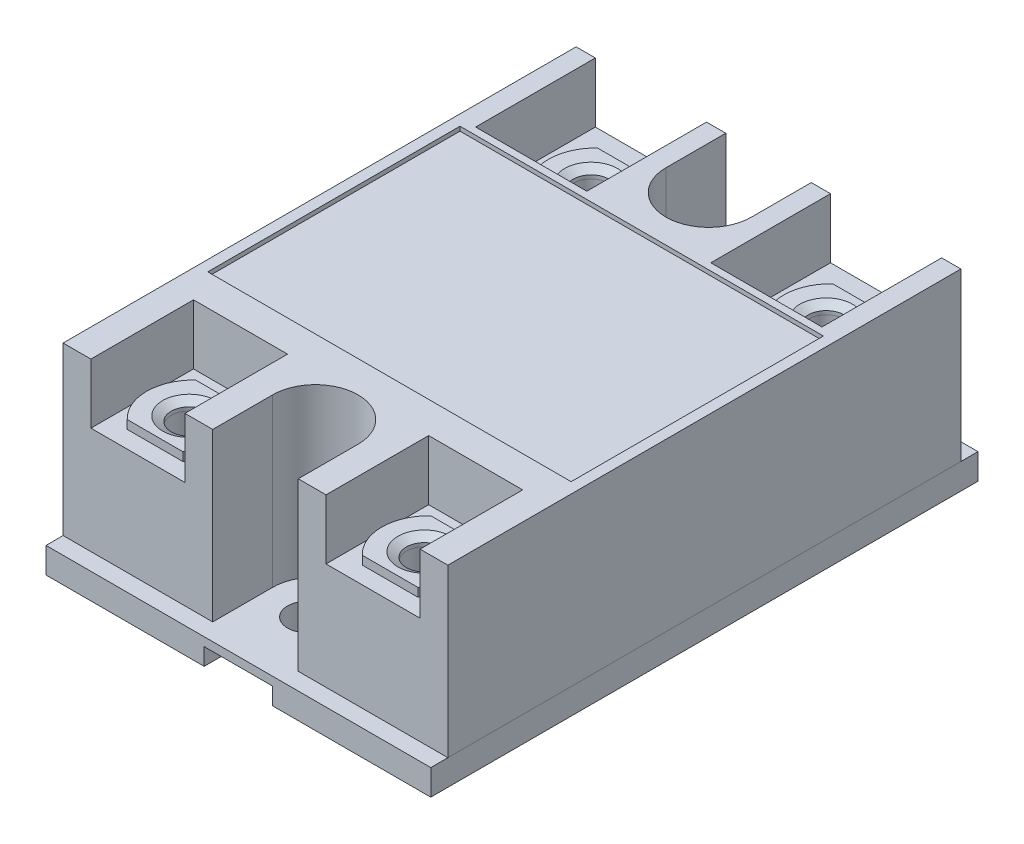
SolidWorks part; units mm, degrees
ref_plane "Front" through (0, 0, 0) normal (0, 0, 1) x (1, 0, 0)
ref_plane "Top" through (0, 0, 0) normal (0, 1, 0) x (1, 0, 0)
ref_plane "Right" through (0, 0, 0) normal (1, 0, 0) x (0, 0, -1)
sketch "Sketch1" plane through (0, 0, 0) normal (0, 1, 0) x (1, 0, 0)
  line L0 (0, 0) -> (0, 60)
  line L1 (0, 0) -> (17.5, 0)
  line L2 (17.5, 0) -> (17.5, 7)
  line L3 (27.5, 0) -> (27.5, 7)
  line L4 (27.5, 0) -> (45, 0)
  line L5 (45, 0) -> (45, 60)
  line L6 (0, 60) -> (17.5, 60)
  line L7 (17.5, 0) -> (27.5, 0) construction
  line L8 (17.5, 60) -> (17.5, 53)
  line L9 (45, 60) -> (27.5, 60)
  line L10 (27.5, 60) -> (27.5, 53)
  arc A0 (27.5, 7) -> (17.5, 7) centre (22.5, 7) ccw
  arc A1 (17.5, 53) -> (27.5, 53) centre (22.5, 53) ccw
  dimension "D1" = 60
  dimension "D2" = 17.5
  dimension "D3" = 7
  dimension "D4" = 10
extrude "Boss-Extrude1" add sketch "Sketch1" along normal blind 19.5
sketch "Sketch2" plane through (0, 19.5, 0) normal (0, 1, 0) x (1, 0, 0)
  line L0 (0, 0) -> (17.5, 0) construction
  line L1 (3.25, 0) -> (14.25, 0)
  line L2 (3.25, 0) -> (3.25, 12)
  line L3 (3.25, 12) -> (14.25, 12)
  line L4 (14.25, 0) -> (14.25, 12)
  line L5 (0, 60) -> (0, 0) construction
  line L7 (22.5, 48) -> (22.5, 12) construction
  line L8 (17.5, 60) -> (0, 60) construction
  line L10 (30.75, 0) -> (30.75, 12)
  line L11 (41.75, 12) -> (30.75, 12)
  line L12 (41.75, 0) -> (41.75, 12)
  line L13 (41.75, 0) -> (30.75, 0)
  line L14 (2.25, 60) -> (15.25, 60)
  line L15 (2.25, 60) -> (2.25, 46)
  line L16 (2.25, 46) -> (15.25, 46)
  line L17 (15.25, 60) -> (15.25, 46)
  line L19 (42.75, 46) -> (29.75, 46)
  line L20 (29.75, 60) -> (29.75, 46)
  line L21 (42.75, 60) -> (29.75, 60)
  line L23 (42.75, 60) -> (42.75, 46)
  arc A0 (17.5, 53) -> (27.5, 53) centre (22.5, 53) ccw construction
  arc A1 (27.5, 7) -> (17.5, 7) centre (22.5, 7) ccw construction
  dimension "D1" = 11
  dimension "D2" = 3.25
  dimension "D3" = 12
  dimension "D4" = 13
  dimension "D5" = 14
  dimension "D6" = 2.25
extrude "Cut-Extrude1" cut sketch "Sketch2" against normal blind 7
sketch "Sketch6" plane through (0, 0, 0) normal (0, 1, 0) x (1, 0, 0)
  line L1 (0, -2) -> (45, -2)
  line L2 (0, -2) -> (0, 62)
  line L3 (0, 62) -> (45, 62)
  line L4 (45, -2) -> (45, 62)
  line L6 (0, 0) -> (17.5, 0) construction
  line L7 (0, 60) -> (0, 0) construction
  line L8 (22.5, 55.5) -> (22.5, 54) construction
  line L9 (24.75, 55.5) -> (24.75, 54)
  line L10 (20.25, 55.5) -> (20.25, 54)
  circle A0 centre (22.5, 6) radius 2.25
  arc A1 (24.75, 55.5) -> (20.25, 55.5) centre (22.5, 55.5) ccw
  arc A2 (20.25, 54) -> (24.75, 54) centre (22.5, 54) ccw
  point P12 (22.5, 54.75)
  dimension "D5" = 4.5
  dimension "D8" = 8
  dimension "D1" = 45
  dimension "D2" = 64
  dimension "D3" = 2
  dimension "D4" = 0
  dimension "D6" = 22.5
  dimension "D7" = 8
  dimension "D9" = 22.5
  dimension "D10" = 4.5
extrude "Boss-Extrude2" add sketch "Sketch6" against normal blind 3 separate body
sketch "Sketch7" plane through (0, 19.5, 0) normal (0, 1, 0) x (1, 0, 0)
  line L0 (22.5, 62) -> (22.5, -11.7233) construction
  line L1 (1.25, 45.1676) -> (43.75, 45.1676)
  line L2 (1.25, 45.1676) -> (1.25, 15.6676)
  line L3 (1.25, 15.6676) -> (43.75, 15.6676)
  line L4 (43.75, 45.1676) -> (43.75, 15.6676)
  line L5 (45, 62) -> (0, 62) construction
  point P8 (22.5, 45.1676)
  dimension "D1" = 42.5
  dimension "D2" = 29.5
extrude "Cut-Extrude2" cut sketch "Sketch7" against normal blind 0.5
hole_wizard "M5x0.8 Tapped Hole1" positions "Sketch13" profile "Sketch12" tap size "M5x0.8" standard "ANSI Metric"
sketch "Sketch13" plane through (0, 12.5, 0) normal (0, 1, 0) x (1, 0, 0)
  line L0 (30.75, 0) -> (41.75, 0) construction
  line L2 (30.75, 12) -> (30.75, 0) construction
  point P0 (36.25, 6)
  dimension "D1" = 6
  dimension "D2" = 5.5
sketch "Sketch12" plane through (36.25, 12.5, -6) normal (1, 0, 0) x (0, 0, 1)
  line L0 (0, 0) -> (0, 15.2618)
  line L1 (0, 15.2618) -> (2.1, 14)
  line L2 (2.1, 14) -> (2.1, 0)
  line L5 (2.1, 0) -> (0, 0)
  line L10 (0, 15.2618) -> (-2.1, 14) construction
  line L11 (0, -6.35) -> (0, 107.95) construction
  dimension "Tap Drill Dia." = 4.2
  dimension "Tap Drill Depth" = 14
  dimension "Drill Angle" = 118
pattern_linear "LPattern1" count 2 spacing 27.5 along (-1, 0, 0) count 2 spacing 47 along (0, 0, -1) of "M5x0.8 Tapped Hole1"
sketch "Sketch14" plane through (0, 12.5, 0) normal (0, 1, 0) x (1, 0, 0)
  line L0 (5.5, 10) -> (12, 10)
  line L1 (5.5, 2) -> (12, 2)
  arc A0 (12, 10) -> (12, 2) centre (8.2251, 6) cw
  arc A1 (5.5, 10) -> (5.5, 2) centre (9.2749, 6) ccw
  circle A2 centre (8.75, 6) radius 2.1
  point P6 (8.75, 10)
  dimension "D4" = 4
  dimension "D5" = 5.5
  dimension "D1" = 6.5
  dimension "D2" = 8
  dimension "D3" = 0
extrude "Boss-Extrude3" add sketch "Sketch14" along normal blind 1 separate body
chamfer "Chamfer1" distance 1 angle 30 1 edges at (8.75, 13.5, -3.9)
pattern_linear "LPattern2" count 2 spacing 27.5 along (1, 0, 0) count 2 spacing 47 along (0, 0, -1)
sketch "Sketch15" plane through (0, -3, 0) normal (0, -1, 0) x (1, 0, 0)
  line L0 (0, 2) -> (45, 2) construction
  line L1 (18.5, 2) -> (26.5, 2)
  line L2 (18.5, 2) -> (18.5, -1)
  line L3 (18.5, -1) -> (26.5, -1)
  line L4 (26.5, 2) -> (26.5, -1)
  line L6 (45, -62) -> (0, -62) construction
  line L7 (26.5, -59) -> (18.5, -59)
  line L8 (26.5, -59) -> (26.5, -62)
  line L9 (26.5, -62) -> (18.5, -62)
  line L10 (18.5, -59) -> (18.5, -62)
  point P6 (22.5, 2)
  point P15 (22.5, -59)
  dimension "D1" = 8
  dimension "D2" = 3
  dimension "D3" = 8
  dimension "D4" = 3
extrude "Cut-Extrude3" cut sketch "Sketch15" against normal blind 2
